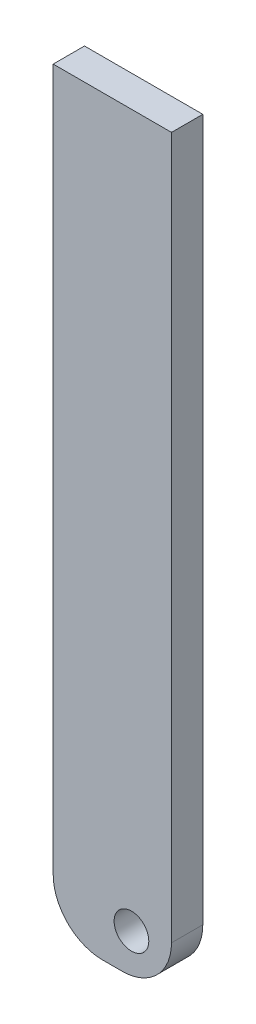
SolidWorks part; units mm, degrees
ref_plane "Front Plane" through (0, 0, 0) normal (0, 0, 1) x (1, 0, 0)
ref_plane "Top Plane" through (0, 0, 0) normal (0, 1, 0) x (1, 0, 0)
ref_plane "Right Plane" through (0, 0, 0) normal (1, 0, 0) x (0, 0, -1)
sketch "Sketch1" plane through (0, 0, 0) normal (0, 0, 1) x (1, 0, 0)
  line L0 (0, 77.9617) -> (0, -48.4617) construction
  line L1 (-15.875, -8) -> (8.125, -8)
  line L2 (-15.875, -8) -> (-15.875, 144.4)
  line L3 (-15.875, 144.4) -> (8.125, 144.4)
  line L5 (8.125, 144.4) -> (8.125, -8)
  circle A0 centre (0, 0) radius 3.5179
  dimension "D1" = 7.0358
  dimension "D2" = 15.875
  dimension "D3" = 152.4
  dimension "D4" = 8
  dimension "D5" = 24
extrude "Boss-Extrude1" add sketch "Sketch1" along normal blind 6.35
fillet "Fillet1" radius 10 2 edges at (-15.875, -8, 3.175) (8.125, -8, 3.175)
